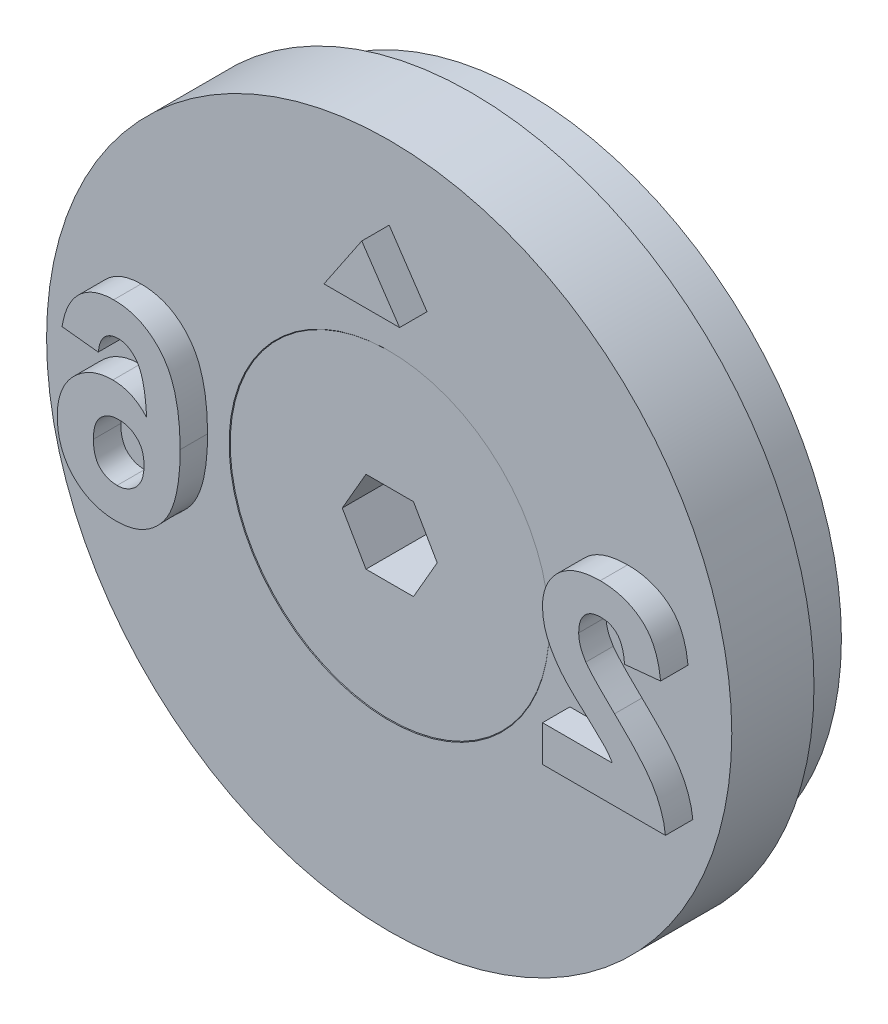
SolidWorks part; units mm, degrees
other "<M5 X .8 FHCS>-<Imported1>"
ref_plane "Front Plane" through (0, 0, 0) normal (0, 0, 1) x (1, 0, 0)
ref_plane "Top Plane" through (0, 0, 0) normal (0, 1, 0) x (1, 0, 0)
ref_plane "Right Plane" through (0, 0, 0) normal (1, 0, 0) x (0, 0, -1)
imported_body "Imported1"
sketch "Sketch1" plane through (0, 0, 0) normal (0, 0, 1) x (1, 0, 0)
  line L0 (0, 9.814) -> (-1.38, 7.768)
  line L1 (-1.38, 7.768) -> (1.38, 7.768)
  line L2 (1.38, 7.768) -> (0, 9.814)
  text T0 "2     6" font "Arial" height 6.858
  dimension "D1" = 3.429
  dimension "D2" = 11.43
extrude "Boss-Extrude1" add sketch "Sketch1" along normal blind 1
other "DeleteFace1"
inserted part "M5 X .8 FHCS"
move or copy body "Body-Move/Copy2" placed by mates yes
